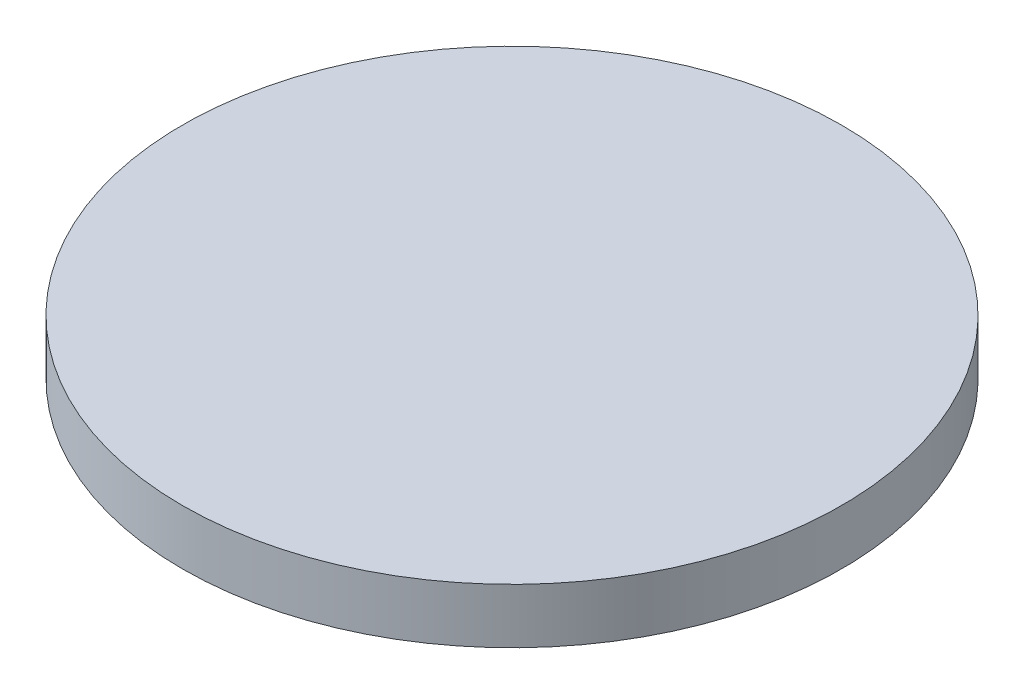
SolidWorks part; units mm, degrees
ref_plane "Front Plane" through (0, 0, 0) normal (0, 0, 1) x (1, 0, 0)
ref_plane "Top Plane" through (0, 0, 0) normal (0, 1, 0) x (1, 0, 0)
ref_plane "Right Plane" through (0, 0, 0) normal (1, 0, 0) x (0, 0, -1)
sketch "Sketch1" plane through (0, 0, 0) normal (0, 1, 0) x (1, 0, 0)
  circle A0 centre (0, 0) radius 15
extrude "Boss-Extrude1" add sketch "Sketch1" along normal blind 2.5
